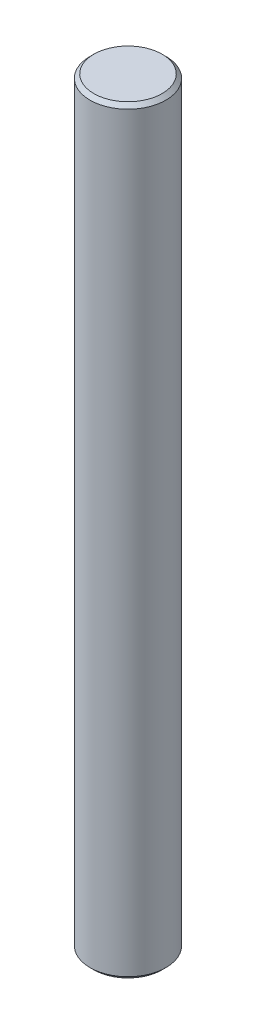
SolidWorks part; units mm, degrees
ref_plane "前视基准面" through (0, 0, 0) normal (0, 0, 1) x (1, 0, 0)
ref_plane "上视基准面" through (0, 0, 0) normal (0, 1, 0) x (1, 0, 0)
ref_plane "右视基准面" through (0, 0, 0) normal (1, 0, 0) x (0, 0, -1)
other "Configuration Table"
sketch "草图1" plane through (0, 0, 0) normal (0, 1, 0) x (1, 0, 0)
  circle A0 centre (0, 0) radius 1
  dimension "D1" = 2
extrude "凸台-拉伸1" add sketch "草图1" along normal blind 20
chamfer "倒角1" distance 0.1 angle 45 2 edges at (0, 0, 1) (0, 20, 1)
